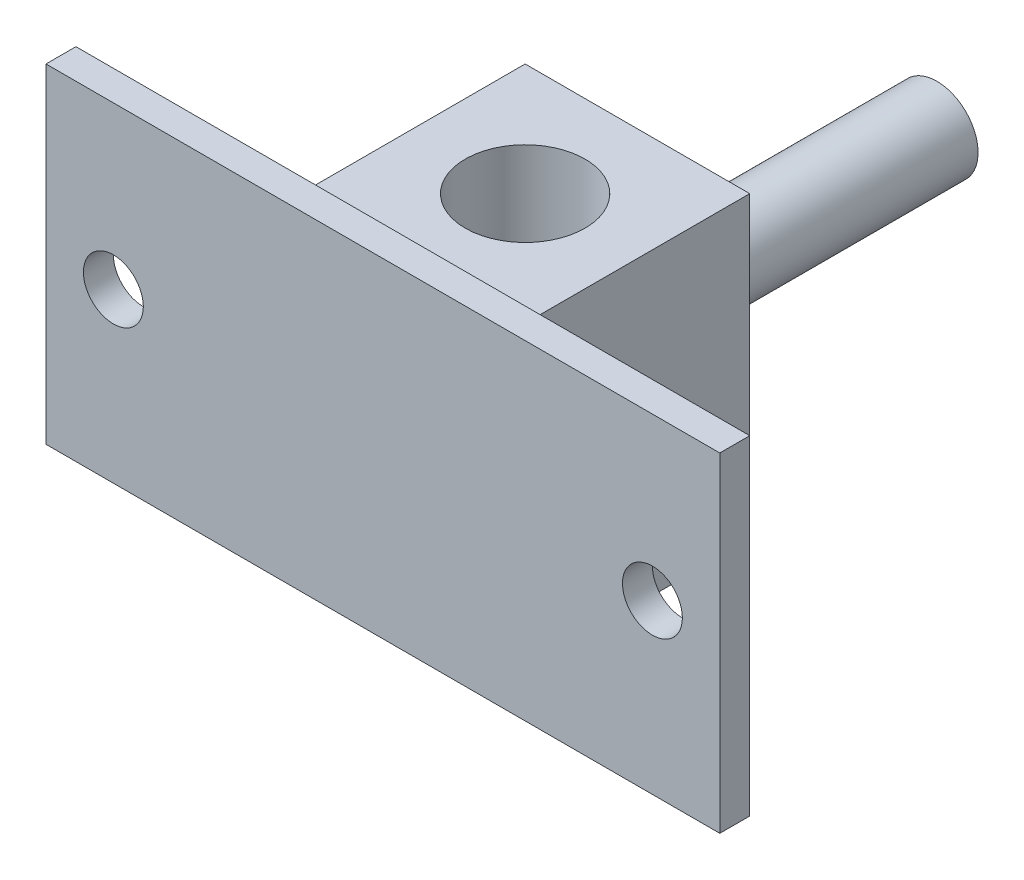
SolidWorks part; units mm, degrees
ref_plane "Front Plane" through (0, 0, 0) normal (0, 0, 1) x (1, 0, 0)
ref_plane "Top Plane" through (0, 0, 0) normal (0, 1, 0) x (1, 0, 0)
ref_plane "Right Plane" through (0, 0, 0) normal (1, 0, 0) x (0, 0, -1)
sketch "Sketch1" plane through (0, 0, 0) normal (0, 0, 1) x (1, 0, 0)
  line L1 (0, 0) -> (15, 0)
  line L2 (0, 0) -> (0, 20)
  line L3 (0, 20) -> (15, 20)
  line L4 (15, 0) -> (15, 20)
  dimension "D1" = 15
  dimension "D2" = 20
extrude "Boss-Extrude1" add sketch "Sketch1" along normal blind 15
sketch "Sketch2" plane through (0, 20, 0) normal (0, 1, 0) x (1, 0, 0)
  line L0 (0, -15) -> (0, 0) construction
  line L1 (15, -15) -> (0, -15) construction
  circle A0 centre (7.5, -7.5) radius 4
  point P4 (7.5, -15)
  dimension "D1" = 8
  dimension "D2" = 7.5
  dimension "D3" = 7.5
extrude "Cut-Extrude1" cut sketch "Sketch2" against normal blind 30
sketch "Sketch3" plane through (0, 0, 15) normal (0, 0, 1) x (1, 0, 0)
  line L0 (0, 20) -> (0, 0) construction
  line L1 (-15, 21) -> (30, 21)
  line L2 (-15, 21) -> (-15, -1)
  line L3 (-15, -1) -> (30, -1)
  line L4 (30, 21) -> (30, -1)
  line L5 (15, 0) -> (15, 20) construction
  line L6 (15, 20) -> (0, 20) construction
  line L7 (0, 0) -> (15, 0) construction
  dimension "D1" = 15
  dimension "D2" = 15
  dimension "D3" = 1
  dimension "D4" = 1
extrude "Boss-Extrude2" add sketch "Sketch3" along normal blind 2
sketch "Sketch4" plane through (0, 0, 17) normal (0, 0, 1) x (1, 0, 0)
  line L0 (-15, 21) -> (-15, -1) construction
  circle A0 centre (-10.5, 10.212) radius 2
  circle A1 centre (25.5, 10.212) radius 2
  dimension "D1" = 4
  dimension "D2" = 4
  dimension "D3" = 36
  dimension "D4" = 4.5
extrude "Cut-Extrude2" cut sketch "Sketch4" against normal blind 2
sketch "Sketch5" plane through (0, 0, 0) normal (0, 0, -1) x (-1, 0, 0)
  circle A0 centre (-7.5, 10) radius 2.75
  dimension "D1" = 5.5
extrude "Boss-Extrude3" add sketch "Sketch5" along normal blind 20
